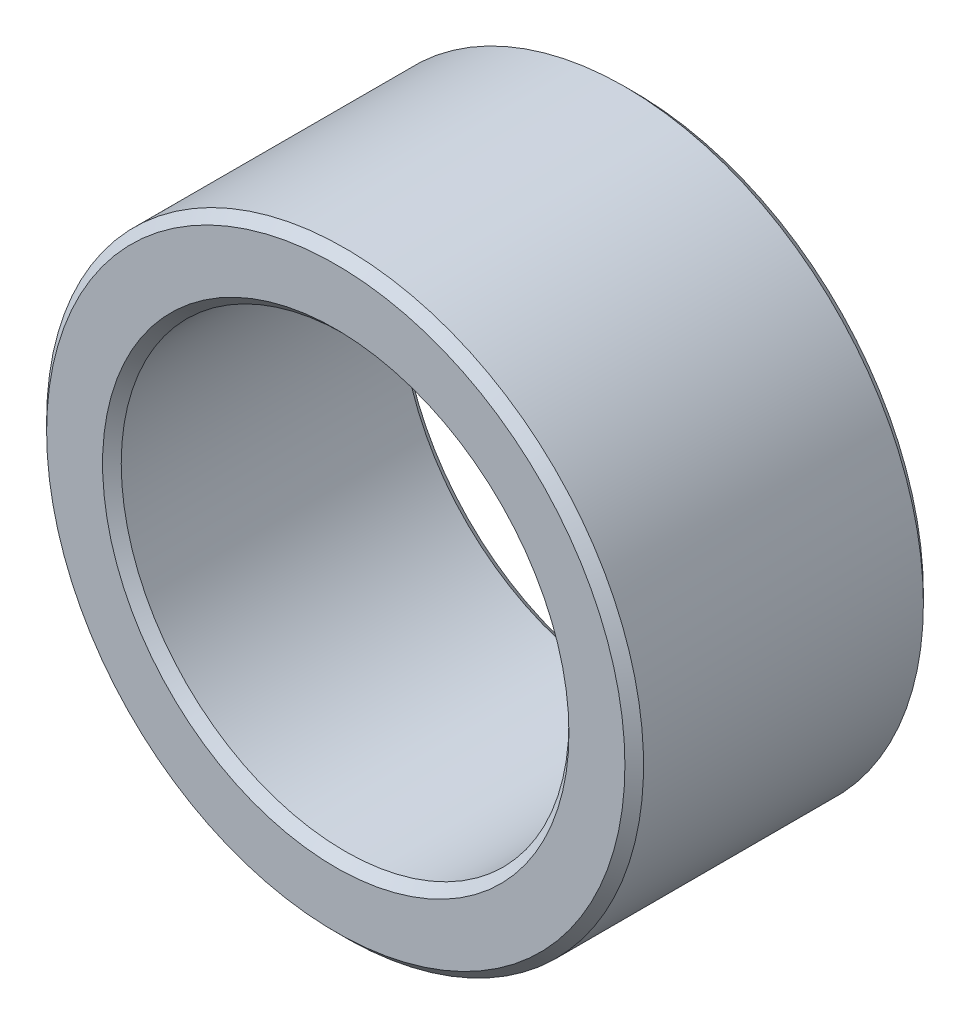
SolidWorks part; units mm, degrees
ref_plane "Plan1" through (0, 0, 0) normal (0, 0, 1) x (1, 0, 0)
ref_plane "Plan2" through (0, 0, 0) normal (0, 1, 0) x (1, 0, 0)
ref_plane "Plan3" through (0, 0, 0) normal (1, 0, 0) x (0, 0, -1)
sketch "Esquisse2" plane through (0, 0, 0) normal (0, 0, 1) x (1, 0, 0)
  circle A0 centre (0, 0) radius 16
  circle A1 centre (0, 0) radius 12
  dimension "D1" = 32
  dimension "D2" = 24
extrude "Base-Extrusion" add sketch "Esquisse2" along normal blind 16
chamfer "Chanfrein1" distance 0.5 angle 45 4 edges at (12, 0, 0) (16, 0, 0) (12, 0, 16) (16, 0, 16)
